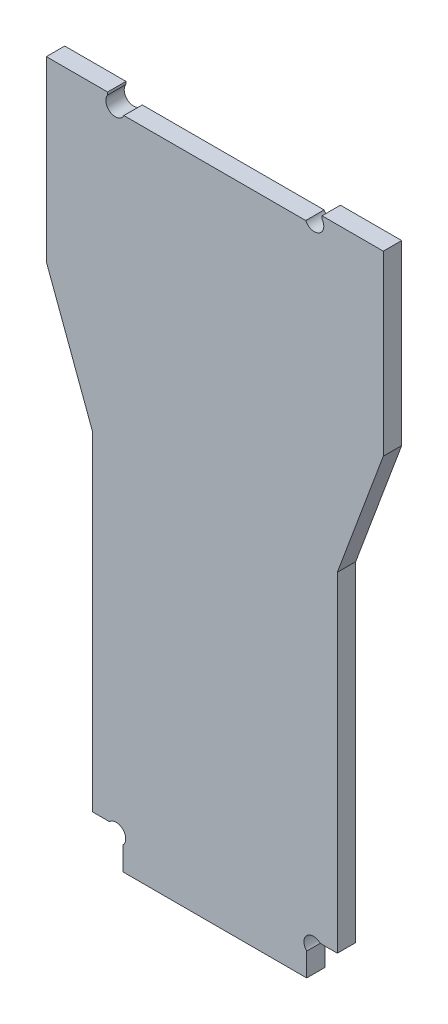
SolidWorks part; units mm, degrees
ref_plane "Plan de face" through (0, 0, 0) normal (0, 0, 1) x (1, 0, 0)
ref_plane "Plan de dessus" through (0, 0, 0) normal (0, 1, 0) x (1, 0, 0)
ref_plane "Plan de droite" through (0, 0, 0) normal (1, 0, 0) x (0, 0, -1)
sketch "Esquisse1" plane through (0, 0, 0) normal (0, 0, 1) x (1, 0, 0)
  line L0 (32.5, 6) -> (32.5, 59.8582)
  line L1 (-31.7369, 0) -> (240.4598, 0) construction
  line L2 (-6.385, 109) -> (124.7418, 109) construction
  line L3 (52.5, -10.4452) -> (52.5, 257.8541) construction
  line L4 (80, 80) -> (72.5, 59.8582)
  line L5 (37.5, 10.1251) -> (37.5, -5.2886) construction
  line L6 (139.5479, 6) -> (-13.1479, 6) construction
  line L7 (37.5, 6) -> (33.3646, 1.8646) construction
  line L8 (25, -8.6072) -> (25, 114.5668) construction
  line L9 (67.5, -5.2886) -> (67.5, 10.1251) construction
  line L10 (134.5687, 107) -> (-13.1479, 107) construction
  line L11 (35, 109) -> (35, 108.5743)
  line L12 (35, 109) -> (25, 109)
  line L13 (25, 109) -> (25, 80)
  line L14 (80, 109) -> (80, 80)
  line L15 (70, 109) -> (80, 109)
  line L16 (70, 109) -> (70, 108.5743)
  line L17 (-6.385, 80) -> (25.1027, 80) construction
  line L18 (32.5, -13.2482) -> (32.5, 91.1356) construction
  line L19 (72.5, 6) -> (72.5, 59.8582)
  line L21 (25, 80) -> (32.5, 59.8582)
  line L22 (67.5, 0) -> (37.5, 0)
  line L23 (37.5, 0) -> (37.5, 3.808)
  line L25 (35.308, 6) -> (32.5, 6)
  line L28 (37.6572, 107) -> (67.3428, 107)
  line L32 (35, 96.1328) -> (35, 114.5668) construction
  line L48 (69.692, 6) -> (72.5, 6)
  line L49 (67.5, 0) -> (67.5, 3.808)
  arc A0 (37.5, 3.808) -> (35.308, 6) centre (36.404, 4.904) ccw
  arc A1 (35, 108.5743) -> (37.6572, 107) centre (36.2609, 107.6728) ccw
  arc A2 (70, 108.5743) -> (67.3428, 107) centre (68.7391, 107.6728) cw
  arc A13 (67.5, 3.808) -> (69.692, 6) centre (68.596, 4.904) cw
  point P98 (52.5, 107)
  point P116 (52.5, 0)
  dimension "D4" = 27.5
  dimension "D7" = 20
  dimension "D1" = 15
  dimension "D2" = 30
  dimension "D3" = 45
  dimension "D5" = 10
  dimension "D8" = 2
extrude "Extrusion1" add sketch "Esquisse1" along normal blind 3
